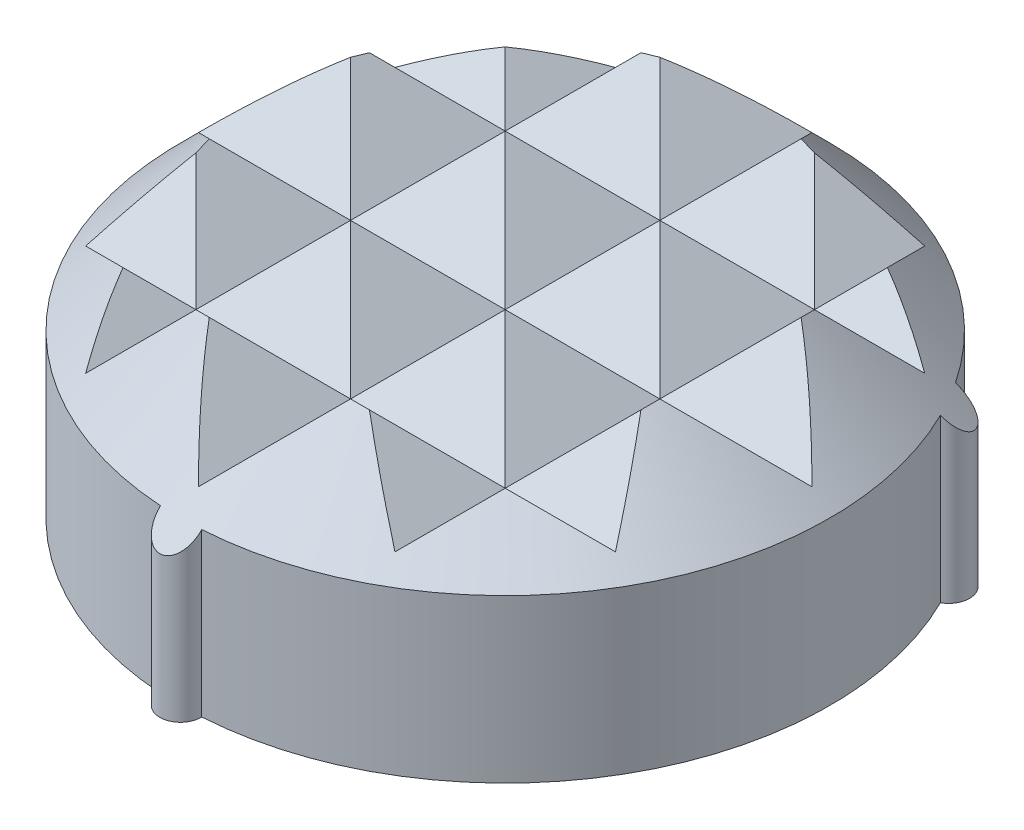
SolidWorks part; units mm, degrees
ref_plane "Front Plane" through (0, 0, 0) normal (0, 0, 1) x (1, 0, 0)
ref_plane "Top Plane" through (0, 0, 0) normal (0, 1, 0) x (1, 0, 0)
ref_plane "Right Plane" through (0, 0, 0) normal (1, 0, 0) x (0, 0, -1)
sketch "Sketch1" plane through (0, 0, 0) normal (0, 0, 1) x (1, 0, 0)
  line L0 (0, 0) -> (0, -66.2626) construction
  line L1 (0, 0) -> (6.7, 0)
  line L2 (6.7, 0) -> (6.7, 5)
  line L4 (6.7, 5) -> (0, 5)
  line L5 (0, 5) -> (0, 0)
  dimension "D1" = 5
  dimension "D2" = 13.4
revolve "Revolve1" add sketch "Sketch1" angle 360 about L0
sketch "Sketch2" plane through (0, 0, 0) normal (0, 1, 0) x (1, 0, 0)
  line L0 (0, 0) -> (0, -5.5148) construction
  line L1 (0, 0) -> (-5.4284, 3.1341) construction
  line L2 (0, 0) -> (5.592, 3.2286) construction
  arc A0 (0.3998, -6.2873) -> (5.6449, 2.7974) centre (0, 0) ccw
  circle A1 centre (0, 0) radius 7.2
  arc A3 (-0.3998, -6.2873) -> (0.3998, -6.2873) centre (0, -6.3) ccw
  arc A4 (-5.2451, 3.4899) -> (-5.6449, 2.7974) centre (-5.456, 3.15) ccw
  arc A5 (-5.6449, 2.7974) -> (-0.3998, -6.2873) centre (0, 0) ccw
  arc A6 (5.6449, 2.7974) -> (5.2451, 3.4899) centre (5.456, 3.15) ccw
  arc A7 (5.2451, 3.4899) -> (-5.2451, 3.4899) centre (0, 0) ccw
  circle A8 centre (0, 0) radius 6.7 construction
  dimension "D1" = 12.6
  dimension "D2" = 0.5
  dimension "D3" = 120
  dimension "D4" = 120
extrude "Extrude1" cut sketch "Sketch2" along normal through all
sketch "Sketch4" plane through (0, 0, 0) normal (0, 1, 0) x (1, 0, 0)
  line L0 (0, 0) -> (4.9919, 0) construction
  line L1 (0, 0) -> (3.8331, -3.8331) construction
  dimension "D1" = 45
ref_plane "Plane1" through (0, 0, 0) normal (0.7071, 0, 0.7071) x (0.7071, 0, -0.7071)
sketch "Sketch6" plane through (0, 0, 0) normal (1, 0, 0) x (0, 0, -1)
  line L0 (0, 0) -> (0, 4.8917) construction
  line L2 (-8.45, 1) -> (-8.45, 5)
  line L3 (-8.45, 5) -> (-4.45, 5)
  line L4 (-4.45, 5) -> (-8.45, 1)
  point P5 (-5.95, 3.5)
  dimension "D1" = 5
  dimension "D2" = 11.9
  dimension "D3" = 45
  dimension "D4" = 1
  dimension "D5" = 1.5
revolve "Cut-Revolve1" cut sketch "Sketch6" angle 360 about L0
sketch "Sketch5" plane through (0, 0, 0) normal (0, 0, 1) x (1, 0, 0)
  line L0 (1.5, 5) -> (0, 3.5)
  line L2 (0, 3.5) -> (-1.5, 5)
  line L3 (-1.5, 5) -> (1.5, 5)
  line L4 (0, 3.5) -> (0, 5) construction
  line L5 (-0.3998, 5) -> (-6.3, 5) construction
  dimension "D1" = 3
extrude "Extrude2" cut sketch "Sketch5" against normal through all and the other way through all
pattern_linear "LPattern1" count 8 spacing 3 along (-1, 0, 0) count 8 spacing 3 along (1, 0, 0) of "Extrude2"
mirror "Mirror1" about plane through (0, 0, 0) normal (0.7071, 0, 0.7071) of "LPattern1", "Extrude2"
sketch "Sketch7" [suppressed] plane through (0, 0, 0) normal (0, 1, 0) x (1, 0, 0)
  line L1 (-0.8, 0.8) -> (0.8, 0.8)
  line L2 (-0.8, 0.8) -> (-0.8, -0.8)
  line L3 (-0.8, -0.8) -> (0.8, -0.8)
  line L4 (0.8, 0.8) -> (0.8, -0.8)
  line L5 (-0.8, 0.8) -> (0.8, -0.8) construction
  line L6 (-0.8, -0.8) -> (0.8, 0.8) construction
  point P0 (0, 0)
  dimension "D1" = 1.6
extrude "Extrude3" [suppressed] add sketch "Sketch7" along normal blind 5.8
draft "Draft1" [suppressed] type of draft neutral plane draft angle 45 faces to draft 4 parameters "D1"=45
sketch "Sketch8" [suppressed] plane through (0, 0, 0) normal (0, 0, 1) x (1, 0, 0)
  line L0 (0, 0) -> (0, 4.8917) construction
  line L2 (-7.15, 1) -> (-7.15, 5)
  line L3 (-7.15, 5) -> (-3.15, 5)
  line L4 (-3.15, 5) -> (-7.15, 1)
  dimension "D1" = 5
  dimension "D2" = 11.9
  dimension "D3" = 45
  dimension "D4" = 1
revolve "Cut-Revolve3" [suppressed] cut sketch "Sketch8" angle 360 about L0
